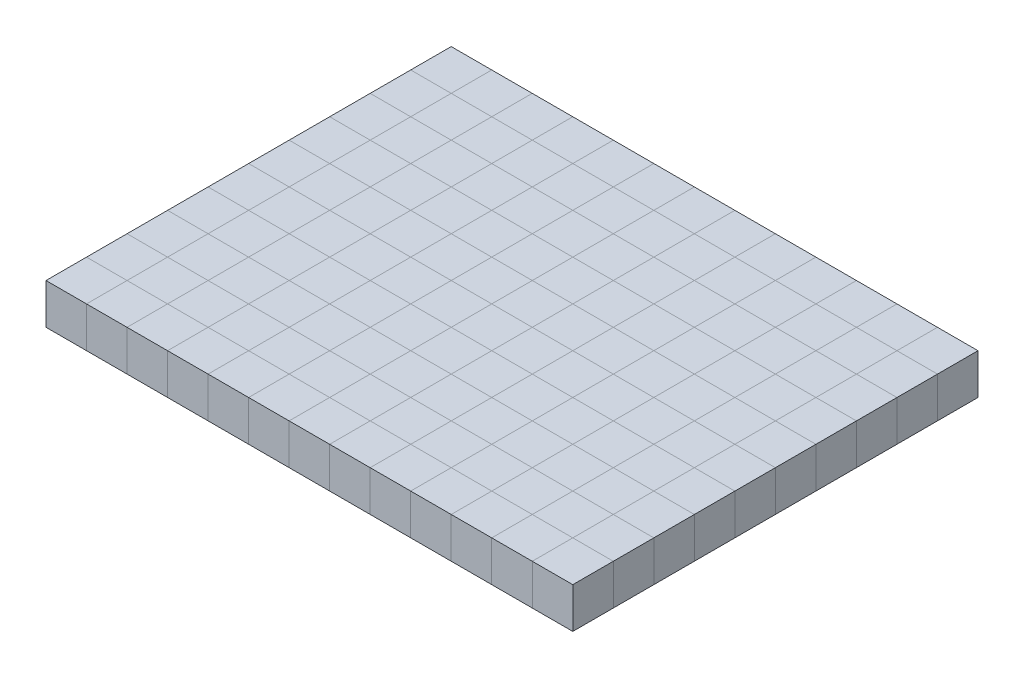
SolidWorks part; units mm, degrees
ref_plane "Front" through (0, 0, 0) normal (0, 0, 1) x (1, 0, 0)
ref_plane "Top" through (0, 0, 0) normal (0, 1, 0) x (1, 0, 0)
ref_plane "Right" through (0, 0, 0) normal (1, 0, 0) x (0, 0, -1)
sketch "Sketch1" plane through (0, 0, 0) normal (0, 1, 0) x (1, 0, 0)
  line L1 (0, 0) -> (3.175, 0)
  line L2 (0, 0) -> (0, 3.175)
  line L3 (0, 3.175) -> (3.175, 3.175)
  line L4 (3.175, 0) -> (3.175, 3.175)
extrude "Boss-Extrude1" add sketch "Sketch1" along normal blind 3.175
pattern_linear "LPattern1" count 13 spacing 3.175 along (1, 0, 0) count 10 spacing 3.175 along (0, 0, -1)
equation "\"PixelSize\"=0.125"
equation "\"D1@Sketch1\"=\"PixelSize\""
equation "\"D3@LPattern1\"=\"PixelSize\""
equation "\"D4@LPattern1\"=\"PixelSize\""
equation "\"NumberOfPixelsWide\"=13"
equation "\"D1@LPattern1\"=\"NumberOfPixelsWide\""
equation "\"NumberOfPixelsHigh\"=10"
equation "\"D2@LPattern1\"=\"NumberOfPixelsHigh\""
